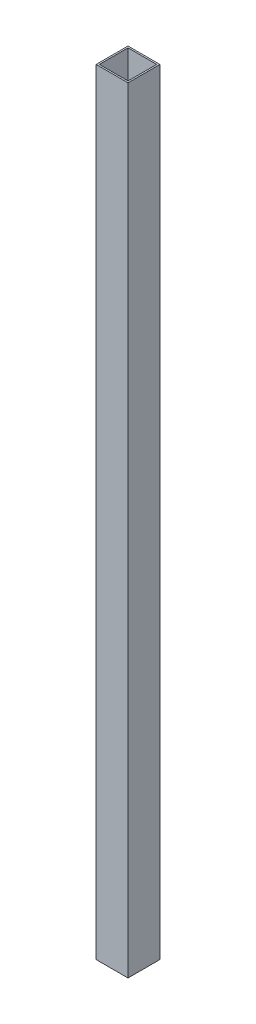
SolidWorks part; units mm, degrees
ref_plane "Front Plane" through (0, 0, 0) normal (0, 0, 1) x (1, 0, 0)
ref_plane "Top Plane" through (0, 0, 0) normal (0, 1, 0) x (1, 0, 0)
ref_plane "Right Plane" through (0, 0, 0) normal (1, 0, 0) x (0, 0, -1)
sketch "Sketch1" plane through (0, 0, 0) normal (0, 1, 0) x (1, 0, 0)
  line L1 (-25, 25) -> (25, 25)
  line L2 (-25, 25) -> (-25, -25)
  line L3 (-25, -25) -> (25, -25)
  line L4 (25, 25) -> (25, -25)
  line L5 (-25, 25) -> (25, -25) construction
  line L6 (-25, -25) -> (25, 25) construction
  point P0 (0, 0)
  dimension "D1" = 50
extrude "Boss-Extrude1" add sketch "Sketch1" along normal blind 1216
shell "Shell1" thickness 2.5
